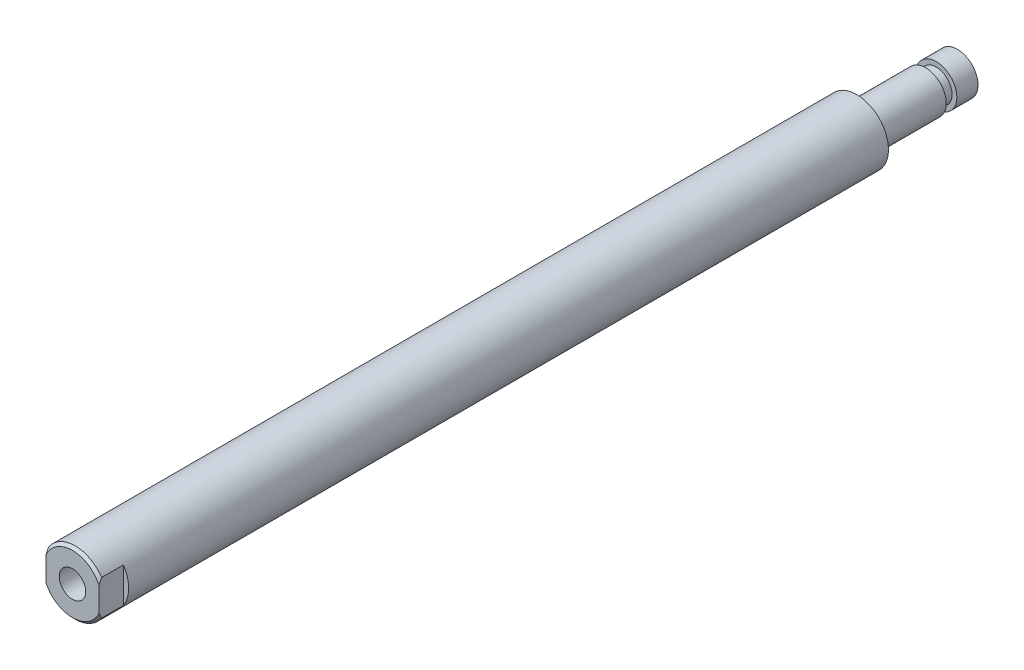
SolidWorks part; units mm, degrees
ref_plane "Plan de face" through (0, 0, 0) normal (0, 0, 1) x (1, 0, 0)
ref_plane "Plan de dessus" through (0, 0, 0) normal (0, 1, 0) x (1, 0, 0)
ref_plane "Plan de droite" through (0, 0, 0) normal (1, 0, 0) x (0, 0, -1)
sketch "Esquisse1" plane through (0, 0, 0) normal (1, 0, 0) x (0, 0, -1)
  line L0 (0, 0) -> (-98.6322, 0) construction
  line L1 (0, 0) -> (0, 6)
  line L2 (0, 6) -> (148, 6)
  line L3 (148, 6) -> (148, 3.9)
  line L4 (149, 3.9) -> (161, 3.9)
  line L5 (163, 3.9) -> (167, 3.9)
  line L7 (167, 3.9) -> (167, 0)
  line L8 (167, 0) -> (0, 0)
  line L10 (161, 3) -> (163, 3)
  line L11 (161, 3) -> (161, 3.9)
  line L13 (163, 3) -> (163, 3.9)
  arc A0 (148, 3.9) -> (149, 3.9) centre (148.5, 3.9) ccw
  dimension "D3" = 0.5
  dimension "D1" = 12
  dimension "D2" = 148
  dimension "D4" = 6
  dimension "D5" = 19
  dimension "D6" = 6
  dimension "D7" = 2
  dimension "D8" = 7.8
revolve "Révolution1" add sketch "Esquisse1" angle 360 about L0
sketch "Esquisse2" plane through (0, 0, 0) normal (0, 1, 0) x (1, 0, 0)
  line L0 (0, 0) -> (0, -3.0357) construction
  line L1 (6, 0) -> (5, 0)
  line L2 (6, 0) -> (6, 4.6)
  line L3 (6, 4.6) -> (5, 4.6)
  line L4 (5, 0) -> (5, 4.6)
  line L5 (-6, 0) -> (-5, 0)
  line L6 (-6, 0) -> (-6, 4.6)
  line L7 (-6, 4.6) -> (-5, 4.6)
  line L8 (-5, 0) -> (-5, 4.6)
  line L9 (-6, 0) -> (6, 0) construction
  dimension "D1" = 4.6
  dimension "D2" = 10
extrude "Enlèv. mat.-Extru.1" cut sketch "Esquisse2" against normal through all and the other way through all
hole_wizard "Trou taraudé M61" positions "Esquisse3D1" profile "Esquisse3" tap size "M6" standard "ISO"
sketch3d "Esquisse3D1"
  line L0 (0, 0, 0) -> (0, 0, -4.6) construction
  point P0 (0, 0, 0)
  point P6 (0, 0, 0)
sketch "Esquisse3" plane through (0, 0, 0) normal (1, 0, 0) x (0, -1, 0)
  line L0 (0, 0) -> (0, 24.5022)
  line L1 (0, 24.5022) -> (2.5, 23)
  line L2 (2.5, 23) -> (2.5, 0)
  line L5 (2.5, 0) -> (0, 0)
  line L10 (0, 24.5022) -> (-2.5, 23) construction
  line L11 (0, -6.35) -> (0, 107.95) construction
  dimension "Diamètre du trou pour taraudage" = 5
  dimension "Profondeur du trou pour taraudage" = 23
  dimension "Angle de pointe" = 118
chamfer "Chanfrein1" distance 0.5 angle 45 2 edges at (0, 6, 0) (0, -6, 0)
